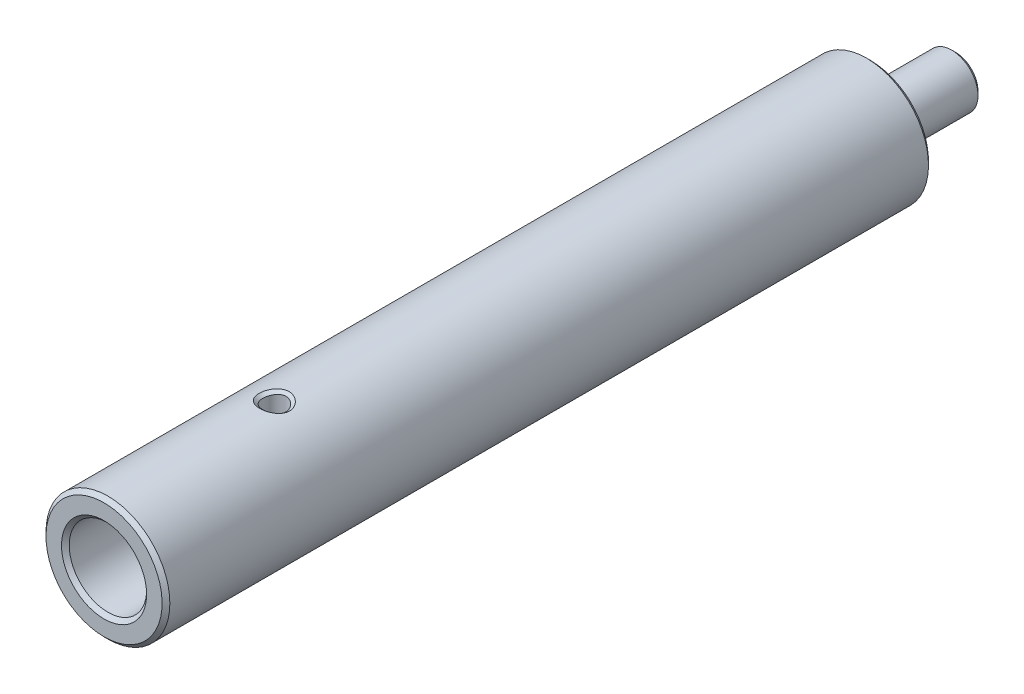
SolidWorks part; units mm, degrees
ref_plane "Спереди" through (0, 0, 0) normal (0, 0, 1) x (1, 0, 0)
ref_plane "Сверху" through (0, 0, 0) normal (0, 1, 0) x (1, 0, 0)
ref_plane "Справа" through (0, 0, 0) normal (1, 0, 0) x (0, 0, -1)
sketch "Эскиз1" plane through (0, 0, 0) normal (1, 0, 0) x (0, 0, -1)
  line L0 (0, 0) -> (0, 2.5)
  line L1 (0, 2.5) -> (-20, 2.5)
  line L2 (-20, 2.5) -> (-20, 4)
  line L3 (-20, 4) -> (29.5, 4)
  line L4 (29.5, 4) -> (29.5, 1.7)
  line L5 (29.5, 1.7) -> (35, 1.7)
  line L6 (35, 1.7) -> (35, 0)
  line L7 (35, 0) -> (0, 0)
  dimension "D1" = 20
  dimension "D2" = 2.5
  dimension "D3" = 4
  dimension "D4" = 5.5
  dimension "D5" = 49.5
  dimension "D6" = 1.7
revolve "Повернуть1" add sketch "Эскиз1" angle 360 about L7
sketch "Эскиз2" plane through (0, 0, 0) normal (0, 1, 0) x (1, 0, 0)
  line L1 (-4, -20) -> (4, -20) construction
  circle A0 centre (0, -9) radius 0.75
  dimension "D1" = 1.5
  dimension "D2" = 11
extrude "Вырез-Вытянуть1" cut sketch "Эскиз2" against normal mid plane 10
chamfer "Фаска1" distance 0.25 angle 45 9 edges at (0, 4, -29.5) (0, 4, 20) (-0.1578, 3.9969, 8.2668) (0.1578, -3.9969, 8.2668) (0, 2.5, 20) (0, 2.5, 0) (0, 1.7, -35) (0.1357, 2.4963, 8.2624) (-0.1357, -2.4963, 8.2624)
